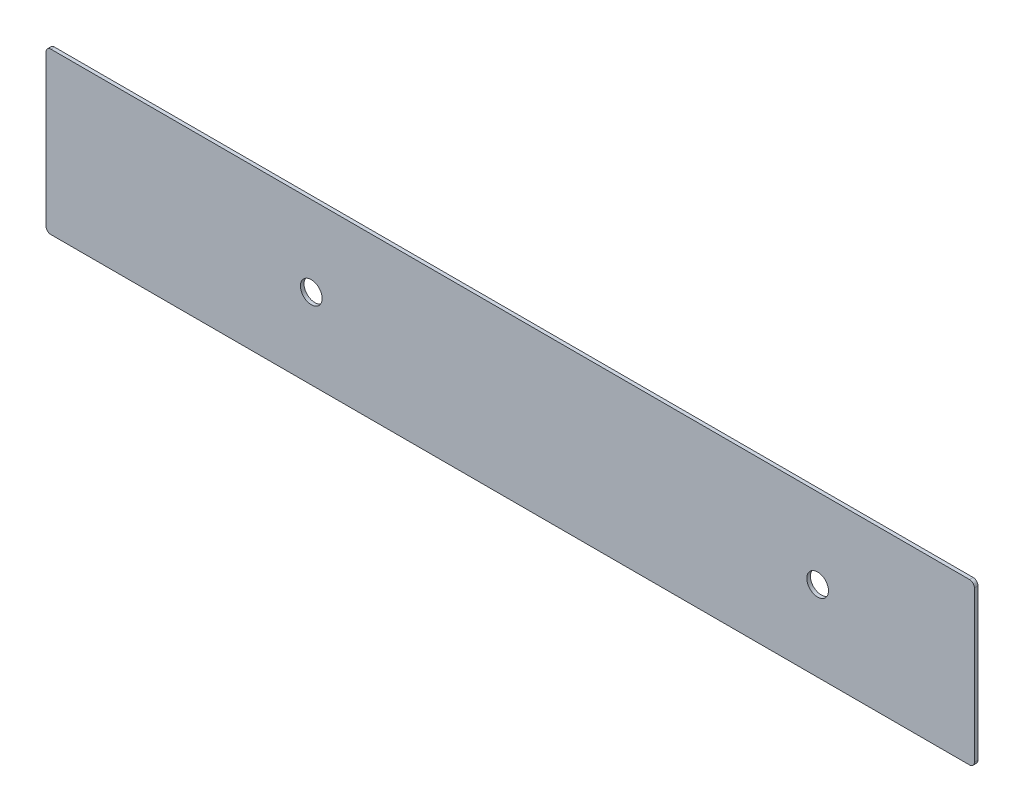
SolidWorks part; units mm, degrees
ref_plane "Front Plane" through (0, 0, 0) normal (0, 0, 1) x (1, 0, 0)
ref_plane "Top Plane" through (0, 0, 0) normal (0, 1, 0) x (1, 0, 0)
ref_plane "Right Plane" through (0, 0, 0) normal (1, 0, 0) x (0, 0, -1)
sketch "Sketch2" plane through (0, 0, 0) normal (0, 0, 1) x (1, 0, 0)
  line L1 (0, 0) -> (385, 0)
  line L2 (0, 0) -> (0, 66.6)
  line L3 (0, 66.6) -> (385, 66.6)
  line L4 (385, 0) -> (385, 66.6)
  circle A0 centre (110, 33.3) radius 4.5
  circle A1 centre (320, 33.3) radius 4.5
  dimension "D2" = 9
  dimension "D1" = 385
  dimension "D3" = 66.6
  dimension "D4" = 210
  dimension "D5" = 110
  dimension "D6" = 33.3
extrude "Boss-Extrude1" add sketch "Sketch2" along normal blind 1.5
fillet "Fillet2" radius 2 4 edges at (385, 66.6, 0.75) (385, 0, 0.75) (0, 0, 0.75) (0, 66.6, 0.75)
